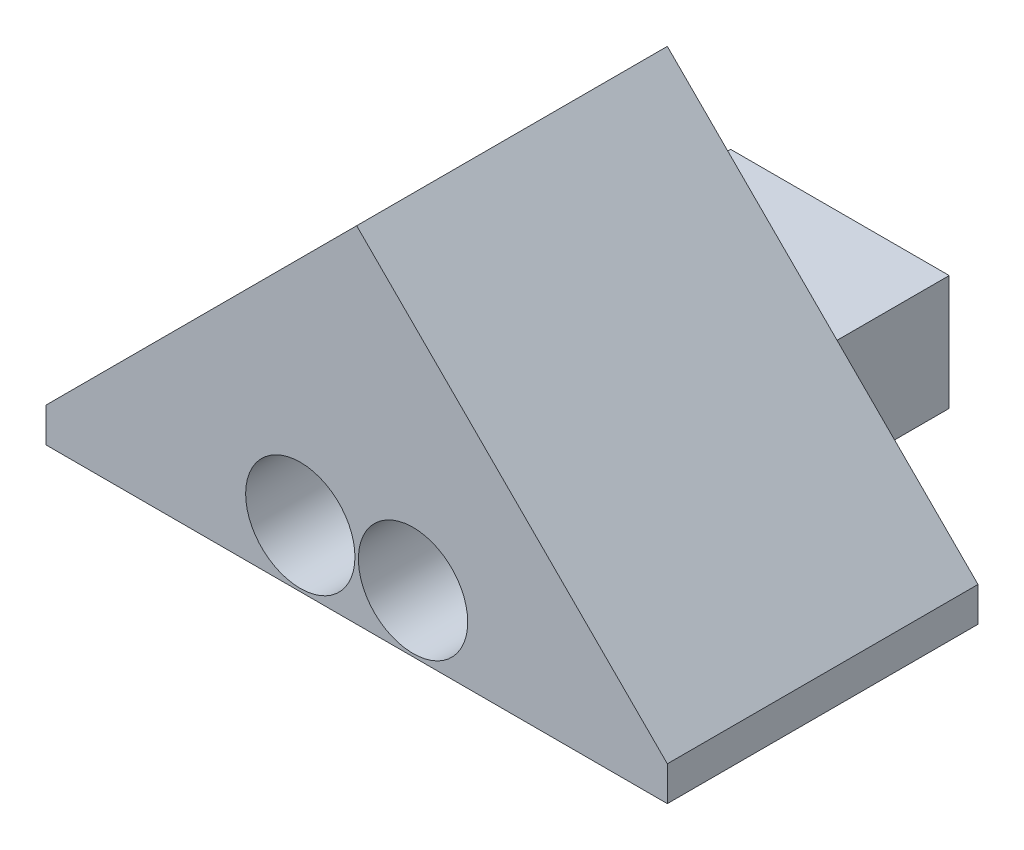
SolidWorks part; units mm, degrees
ref_plane "Plan de face" through (0, 0, 0) normal (0, 0, 1) x (1, 0, 0)
ref_plane "Plan de dessus" through (0, 0, 0) normal (0, 1, 0) x (1, 0, 0)
ref_plane "Plan de droite" through (0, 0, 0) normal (1, 0, 0) x (0, 0, -1)
sketch "Esquisse1" plane through (0, 0, 0) normal (0, 0, 1) x (1, 0, 0)
  line L1 (-21.5476, 22.8327) -> (32.4524, 22.8327)
  line L2 (-21.5476, 22.8327) -> (-21.5476, -7.1673)
  line L3 (-21.5476, -7.1673) -> (32.4524, -7.1673)
  line L4 (32.4524, 22.8327) -> (32.4524, -7.1673)
  dimension "D1" = 54
  dimension "D2" = 30
extrude "Boss.-Extru.1" add sketch "Esquisse1" along normal blind 27
sketch "Esquisse2" plane through (0, 0, 27) normal (0, 0, 1) x (1, 0, 0)
  line L0 (-21.5476, -4.1673) -> (5.4524, 22.8327)
  line L1 (-21.5476, 22.8327) -> (-21.5476, -7.1673) construction
  line L2 (32.4524, 22.8327) -> (-21.5476, 22.8327) construction
  line L3 (5.4524, 22.8327) -> (-21.5476, 22.8327)
  line L4 (-21.5476, 22.8327) -> (-21.5476, -4.1673)
  dimension "D1" = 27
extrude "Enlèv. mat.-Extru.1" cut sketch "Esquisse2" against normal blind 27
sketch "Esquisse3" plane through (0, 0, 27) normal (0, 0, 1) x (1, 0, 0)
  line L0 (5.4524, 22.8327) -> (32.4524, -4.1673)
  line L1 (32.4524, -7.1673) -> (32.4524, 22.8327) construction
  line L2 (32.4524, -4.1673) -> (32.4524, 22.8327)
  line L3 (32.4524, 22.8327) -> (5.4524, 22.8327)
  dimension "D1" = 27
extrude "Enlèv. mat.-Extru.2" cut sketch "Esquisse3" against normal blind 27
sketch "Esquisse4" plane through (0, 0, 0) normal (0, 0, -1) x (-1, 0, 0)
  line L0 (21.5476, -7.1673) -> (-32.4524, -7.1673) construction
  line L1 (-14.9524, 2.8327) -> (4.0476, 2.8327)
  line L2 (-14.9524, 2.8327) -> (-14.9524, -7.1673)
  line L3 (-14.9524, -7.1673) -> (4.0476, -7.1673)
  line L4 (4.0476, 2.8327) -> (4.0476, -7.1673)
  line L5 (-32.4524, -7.1673) -> (-32.4524, -4.1673) construction
  circle A0 centre (-10.3524, -2.1673) radius 2
  circle A1 centre (-0.5524, -2.1673) radius 2
  dimension "D5" = 4
  dimension "D6" = 4
  dimension "D1" = 19
  dimension "D2" = 10
  dimension "D3" = 0
  dimension "D4" = 17.5
  dimension "D7" = 0
  dimension "D8" = 5
  dimension "D9" = 9.8
  dimension "D10" = 4.6
extrude "Boss.-Extru.2" add sketch "Esquisse4" along normal blind 15
sketch "Esquisse5" plane through (0, 0, 0) normal (0, 0, -1) x (-1, 0, 0)
  circle A0 centre (-0.5524, -2.1673) radius 4.75
  circle A1 centre (-10.3524, -2.1673) radius 4.75
  dimension "D1" = 9.5
  dimension "D2" = 9.5
extrude "Enlèv. mat.-Extru.20" cut sketch "Esquisse5" against normal blind 36
